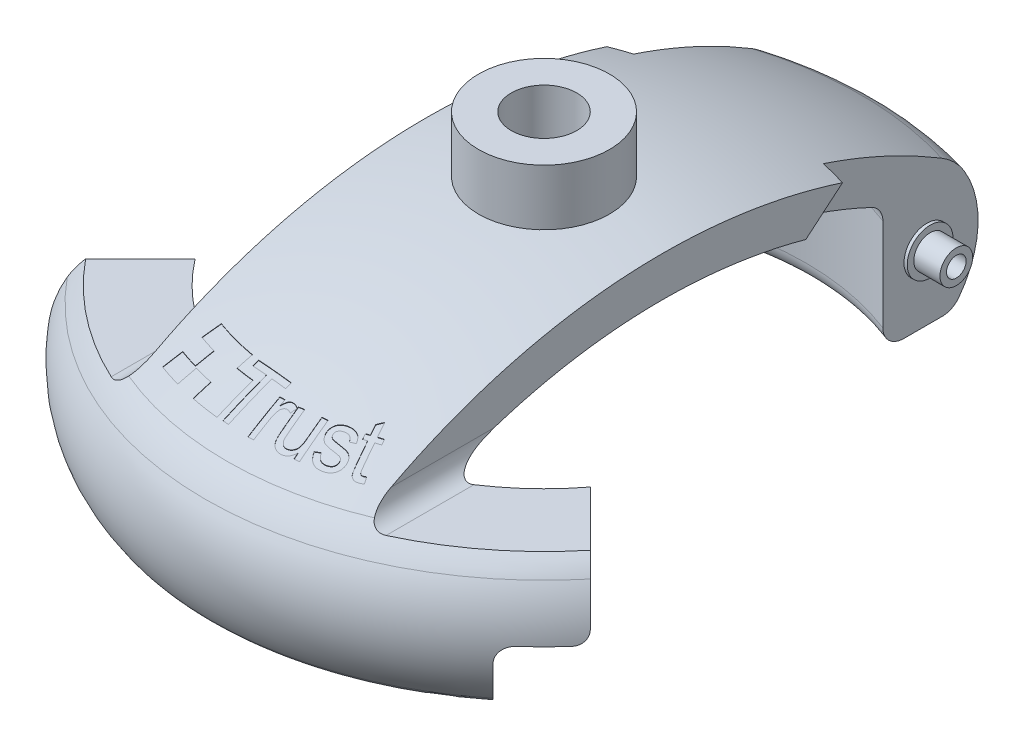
SolidWorks part; units mm, degrees
ref_plane "Спереди" through (0, 0, 0) normal (0, 0, 1) x (1, 0, 0)
ref_plane "Сверху" through (0, 0, 0) normal (0, 1, 0) x (1, 0, 0)
ref_plane "Справа" through (0, 0, 0) normal (1, 0, 0) x (0, 0, -1)
body saved out of another part "Заготовка-Дет1-1"
ref_plane "Плоскость1" through (0, 0, -440) normal (0, 0, 1) x (1, 0, 0)
sketch "Эскиз1" plane through (0, 0, -440) normal (0, 0, 1) x (1, 0, 0)
  line L0 (0, 469.372) -> (0, -99.0577) construction
  line L1 (458.8602, 100) -> (-486.1012, 100) construction
  line L2 (415.8799, 0) -> (-486.1012, 0) construction
  line L3 (-145, 100) -> (-145, 135)
  line L4 (-145, 175.9295) -> (-145, 12.5) construction
  line L5 (-145, 135) -> (-150, 135)
  line L6 (-150, 135) -> (-150, 125)
  line L7 (-150, 125) -> (-190, 125)
  line L8 (-190, 125) -> (-190, 100)
  line L9 (-190, 100) -> (-145, 100)
  line L10 (190, 100) -> (145, 100)
  line L11 (190, 125) -> (190, 100)
  line L12 (150, 125) -> (190, 125)
  line L13 (150, 135) -> (150, 125)
  line L14 (145, 135) -> (150, 135)
  line L15 (145, 100) -> (145, 135)
  dimension "D1" = 100
  dimension "D2" = 25
  dimension "D3" = 35
  dimension "D4" = 5
  dimension "D5" = 40
revolve "Повернуть1" add sketch "Эскиз1" angle 360 about L1
sketch "Эскиз2" plane through (-190, 0, 0) normal (-1, 0, 0) x (0, 0, 1)
  line L0 (0, 514.4398) -> (0, -136.4559) construction
  circle A0 centre (-440, 100) radius 15
  dimension "D1" = 30
extrude "Вырез-Вытянуть1" cut sketch "Эскиз2" against normal up to surface (380 mm away)
sketch "Эскиз3" plane through (0, 430, 0) normal (0, 1, 0) x (1, 0, 0)
  line L0 (0, 572.5094) -> (0, -582.4748) construction
  line L1 (0, 0) -> (-155.5085, -427.256) construction
  line L2 (0, 0) -> (-97.0092, -550.1667) construction
  line L3 (0, 0) -> (-63.2787, -450.2515) construction
  line L4 (-47.5266, -452.1856) -> (0, 0) construction
  line L5 (-42.3002, -402.4595) -> (-47.5266, -452.1856)
  line L6 (-66.7983, -378.8323) -> (-70.2713, -398.5284)
  line L7 (0, 0) -> (-162.5204, -566.7762) construction
  line L8 (-139.4335, -383.0905) -> (-131.5671, -361.4775)
  line L9 (-155.5085, -427.256) -> (-147.3, -404.7034)
  line L10 (-112.3708, -391.8837) -> (-118.7105, -413.9927)
  line L11 (0, 0) -> (-117.538, -577.7176) construction
  line L12 (-121.507, -438.14) -> (-115.3605, -415.9765)
  line L13 (-86.0624, -423.0103) -> (-90.6479, -445.5486)
  line L14 (0, 0) -> (-154.1576, -555.8744) construction
  arc A0 (-90.6479, -445.5486) -> (-47.5266, -452.1856) centre (0, 0) ccw
  arc A1 (-66.7983, -378.8323) -> (-131.5671, -361.4775) centre (0, 0) cw
  arc A2 (-176.1226, -419.1795) -> (176.1226, -419.1795) centre (0, 0) ccw
  arc A3 (-155.5085, -427.256) -> (-121.507, -438.14) centre (0, 0) ccw
  arc A5 (-63.2787, -450.2515) -> (147.6587, -430.032) centre (0, 0) ccw construction
  arc A6 (-42.3002, -402.4595) -> (-70.2713, -398.5284) centre (0, 0) cw
  arc A7 (-139.4335, -383.0905) -> (-112.3708, -391.8837) centre (0, 0) ccw
  arc A8 (-147.3, -404.7034) -> (-118.7105, -413.9927) centre (0, 0) ccw
  arc A9 (-115.3605, -415.9765) -> (-86.0624, -423.0103) centre (0, 0) ccw
  text T0 "Trust" font "Arial" height 70
  point P27 (-124.7164, -437.2373)
  dimension "D5" = 70
  dimension "D7" = 20
  dimension "D9" = 24
  dimension "D10" = 23
  dimension "D13" = 23
  dimension "D2" = 8
  dimension "D3" = 10
  dimension "D4" = 2
  dimension "D6" = 2
  dimension "D8" = 4
  dimension "D11" = 0.5
  dimension "D12" = 4
  dimension "D1" = 30
extrude "Вырез-Вытянуть2" cut sketch "Эскиз3" against normal offset from surface (169.8391 mm away) 0.5
